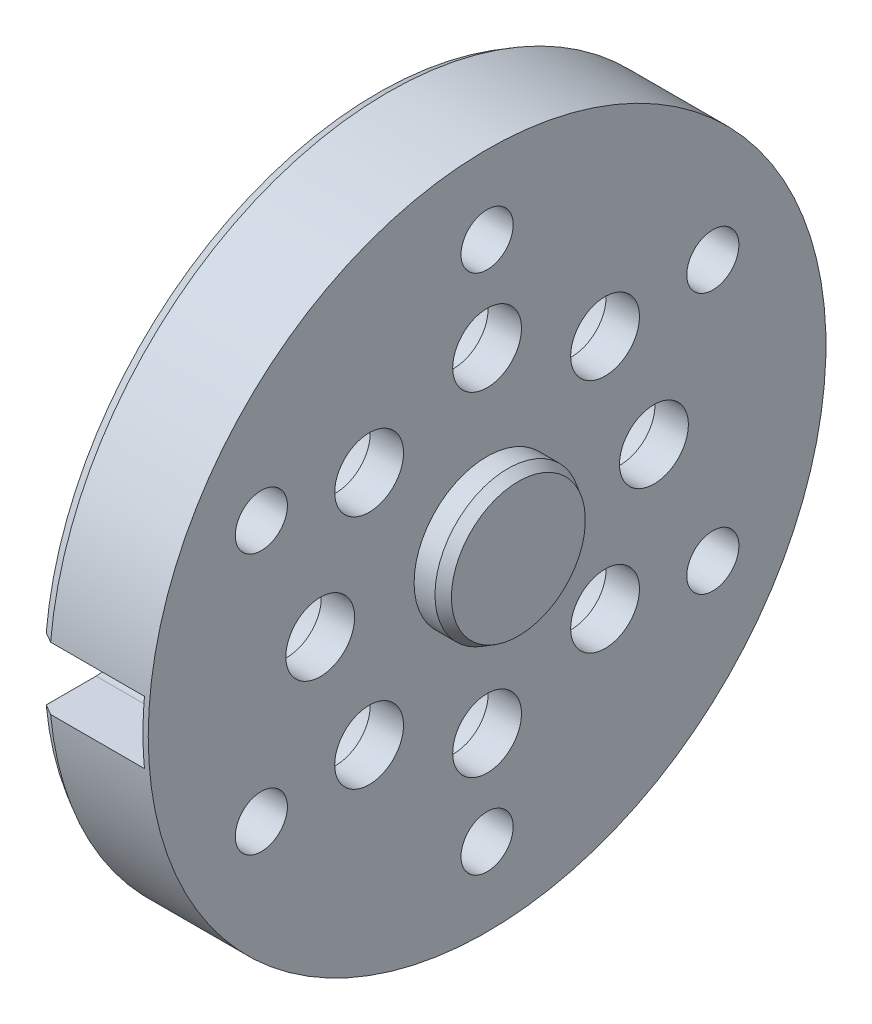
SolidWorks part; units mm, degrees
ref_plane "前视基准面" through (0, 0, 0) normal (0, 0, 1) x (1, 0, 0)
ref_plane "上视基准面" through (0, 0, 0) normal (0, 1, 0) x (1, 0, 0)
ref_plane "右视基准面" through (0, 0, 0) normal (1, 0, 0) x (0, 0, -1)
sketch "草图1" plane through (0, 0, 0) normal (0, 0, 1) x (1, 0, 0)
  line L0 (0, 0) -> (111.7583, 0) construction
  line L1 (0, 32.5) -> (0, 9)
  line L2 (0, 9) -> (6, 9)
  line L3 (6, 9) -> (6, 0)
  line L4 (6, 0) -> (13.5, 0)
  line L5 (10.5, 7) -> (13.5, 7)
  line L6 (13.5, 7) -> (13.5, 0)
  line L7 (10.5, 7) -> (10.5, 32.5)
  line L9 (10.5, 32.5) -> (0, 32.5)
  dimension "D3" = 6
  dimension "D4" = 14
  dimension "D5" = 3
  dimension "D6" = 10.5
  dimension "D7" = 18
  dimension "D8" = 65
revolve "旋转1" add sketch "草图1" angle 360 about L0
hole_wizard "M6 螺纹孔1" positions "草图6" profile "草图5" tap size "M6" standard "GB"
sketch "草图6" plane through (0, 0, 0) normal (-1, 0, 0) x (0, 0, 1)
  line L1 (0, 0) -> (0, 25) construction
  circle A0 centre (0, 0) radius 25 construction
  point P0 (0, 25)
  point P40 (21.6506, 12.5)
  point P41 (21.6506, -12.5)
  point P42 (0, -25)
  point P43 (-21.6506, -12.5)
  point P44 (-21.6506, 12.5)
  point P45 (0, 25)
  point P46 (21.6506, 12.5)
  point P47 (21.6506, -12.5)
  point P48 (0, -25)
  dimension "D1" = 50
  dimension "D2" = 6
sketch "草图5" plane through (0, 25, 0) normal (0, 1, 0) x (0, 0, 1)
  line L0 (0, 0) -> (0, 13.5)
  line L1 (0, 13.5) -> (2.5, 13.5)
  line L2 (2.5, 13.5) -> (2.5, 0)
  line L5 (2.5, 0) -> (0, 0)
  line L11 (0, -6.35) -> (0, 107.95) construction
  dimension "通孔螺纹孔钻头直径" = 5
  dimension "通孔螺纹孔钻头深度" = 13.5
hole_wizard "Ø4.0 (4) 直径孔1" positions "草图8" profile "草图7" hole size "Ø4.0" standard "ISO"
sketch "草图8" plane through (0, 0, 0) normal (-1, 0, 0) x (0, 0, 1)
  point P0 (-25, 0)
  dimension "D1" = 25
sketch "草图7" plane through (0, 0, -25) normal (0, 1, 0) x (0, 0, 1)
  line L0 (0, 0) -> (0, 5.2017)
  line L1 (0, 5.2017) -> (2, 4)
  line L2 (2, 4) -> (2, 0)
  line L5 (2, 0) -> (0, 0)
  line L10 (0, 5.2017) -> (-2, 4) construction
  line L11 (0, -6.35) -> (0, 107.95) construction
  dimension "孔直径" = 4
  dimension "孔深度" = 4
  dimension "导头角度" = 118
hole_wizard "打孔尺寸根据内六角圆柱头螺钉的类型1" positions "草图10" profile "草图9" counterbore size "M6" standard "GB"
sketch "草图10" plane through (0, 0, 0) normal (-1, 0, 0) x (0, 0, 1)
  circle A0 centre (0, 0) radius 16 construction
  point P0 (0, 16)
  dimension "D1" = 32
sketch "草图9" plane through (0, 16, 0) normal (0, 1, 0) x (0, 0, 1)
  line L0 (0, 0) -> (0, 13.5)
  line L1 (0, 13.5) -> (3.3, 13.5)
  line L3 (3.3, 13.5) -> (3.3, 7.3)
  line L4 (3.3, 7.3) -> (5.5, 7.3)
  line L5 (5.5, 7.3) -> (5.5, 0)
  line L7 (5.5, 0) -> (0, 0)
  line L11 (0, -6.35) -> (0, 107.95) construction
  dimension "通孔孔直径" = 6.6
  dimension "通孔孔深度" = 13.5
  dimension "柱形沉头孔直径" = 11
  dimension "柱形沉头孔深度" = 7.3
sketch "草图11" plane through (0, 0, 0) normal (-1, 0, 0) x (0, 0, 1)
  line L0 (0, 0) -> (48.3425, 0) construction
  line L1 (27, 3) -> (38.6258, 3)
  line L2 (27, 3) -> (27, -3) construction
  line L3 (27, -3) -> (38.6258, -3)
  line L4 (38.6258, 3) -> (38.6258, -3)
  arc A0 (27, 3) -> (27, -3) centre (27, 0) ccw
  dimension "D1" = 6
  dimension "D2" = 27
extrude "切除-拉伸1" cut sketch "草图11" against normal blind 10
chamfer "倒角1" distance 1 angle 30 2 edges at (0, 0, 9) (0, 0, -32.5)
chamfer "倒角2" distance 1 angle 30 1 edges at (13.5, 0, 7)
pattern_circular "阵列(圆周)1" count 8 over 360 about axis through (0, 0, 0) along (1, 0, 0) of "打孔尺寸根据内六角圆柱头螺钉的类型1"
